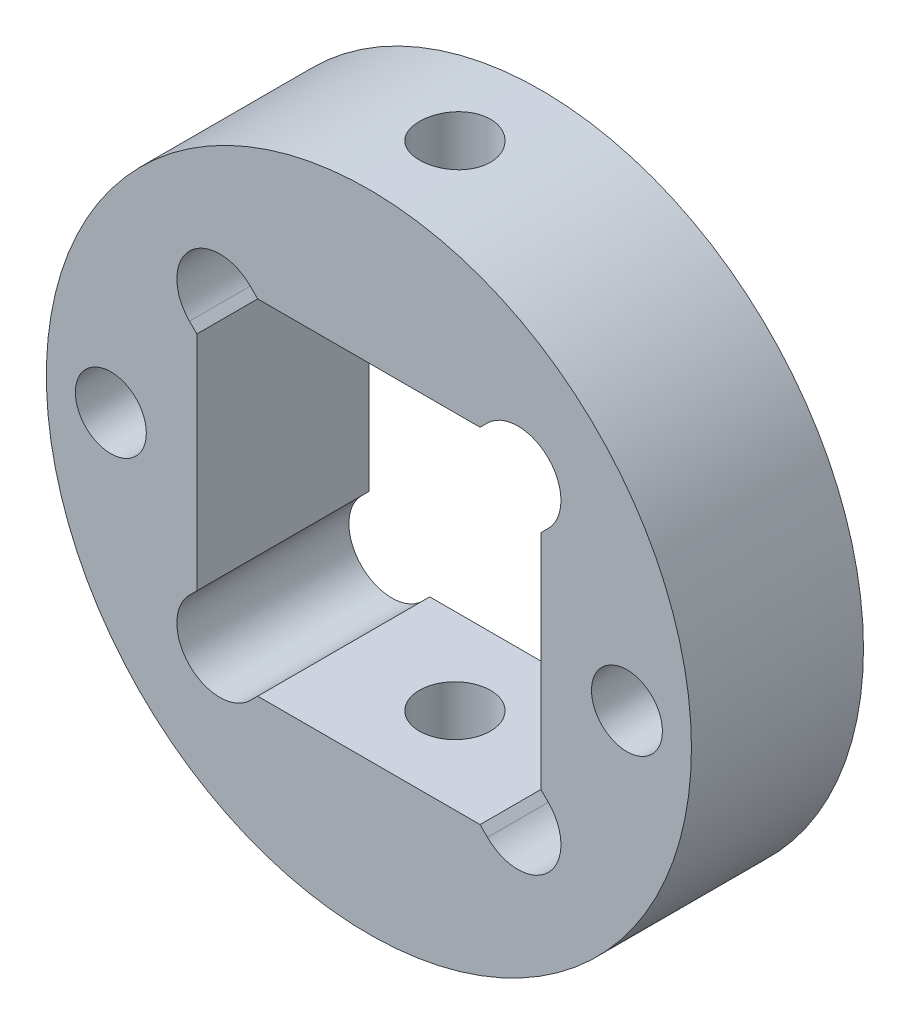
SolidWorks part; units mm, degrees
ref_plane "Plan de face" through (0, 0, 0) normal (0, 0, 1) x (1, 0, 0)
ref_plane "Plan de dessus" through (0, 0, 0) normal (0, 1, 0) x (1, 0, 0)
ref_plane "Plan de droite" through (0, 0, 0) normal (1, 0, 0) x (0, 0, -1)
sketch "Esquisse1" plane through (0, 0, 0) normal (0, 0, 1) x (1, 0, 0)
  line L0 (7.9903, 7.9903) -> (10.6336, 5.347) construction
  line L1 (-5.1716, 8) -> (5.1716, 8)
  line L2 (-8, 5.1716) -> (-8, -5.1716)
  line L3 (-5.1716, -8) -> (5.1716, -8)
  line L4 (8, 5.1716) -> (8, -5.1716)
  line L5 (7.9903, 7.9903) -> (6.9296, 6.9296) construction
  line L6 (8.3439, 5.5154) -> (3.5743, 10.285) construction
  line L7 (5.5154, 8.3439) -> (5.1716, 8)
  line L8 (8.3439, 5.5154) -> (8, 5.1716)
  line L9 (8.3439, -5.5154) -> (8, -5.1716)
  line L10 (5.5154, -8.3439) -> (5.1716, -8)
  line L11 (7.9903, -7.9903) -> (6.9296, -6.9296) construction
  line L12 (-5.5154, -8.3439) -> (-5.1716, -8)
  line L13 (-8.3439, -5.5154) -> (-8, -5.1716)
  line L14 (-7.9903, -7.9903) -> (-6.9296, -6.9296) construction
  line L15 (-8.3439, 5.5154) -> (-8, 5.1716)
  line L16 (-5.5154, 8.3439) -> (-5.1716, 8)
  line L17 (-7.9903, 7.9903) -> (-6.9296, 6.9296) construction
  arc A0 (8.3439, 5.5154) -> (5.5154, 8.3439) centre (6.9296, 6.9296) ccw
  arc A1 (5.5154, -8.3439) -> (8.3439, -5.5154) centre (6.9296, -6.9296) ccw
  arc A2 (-8.3439, -5.5154) -> (-5.5154, -8.3439) centre (-6.9296, -6.9296) ccw
  arc A3 (-5.5154, 8.3439) -> (-8.3439, 5.5154) centre (-6.9296, 6.9296) ccw
  circle A4 centre (0, 0) radius 15
  point P0 (-7.5417, 8.8)
  point P1 (8, -8)
  point P2 (-8, -8)
  point P4 (-15, 15)
  point P6 (15, 15)
  point P7 (15, -15)
  point P8 (-15, -15)
  point P10 (0, 0)
  dimension "D6" = 45
  dimension "D5" = 4
  dimension "D1" = 16
  dimension "D2" = 8
  dimension "D4" = 8
  dimension "D7" = 9.8
  dimension "D8" = 4
extrude "Boss.-Extru.1" add sketch "Esquisse1" along normal mid plane 8
hole_wizard "Trou taraudé M41" positions "Esquisse3" profile "Esquisse2" tap size "M4" standard "ISO"
sketch "Esquisse3" plane through (0, 0, 4) normal (0, 0, 1) x (1, 0, 0)
  point P0 (12, 0)
  dimension "D1" = 12
sketch "Esquisse2" plane through (12, 0, 4) normal (1, 0, 0) x (0, -1, 0)
  line L0 (0, 0) -> (0, 8)
  line L1 (0, 8) -> (1.65, 8)
  line L2 (1.65, 8) -> (1.65, 0)
  line L5 (1.65, 0) -> (0, 0)
  line L11 (0, -6.35) -> (0, 107.95) construction
  dimension "Diamètre du trou pour taraudage jusqu'au prochain" = 3.3
  dimension "Profondeur du trou pour taraudage jusqu'au prochain" = 8
mirror "Symétrie1" about plane through (0, 0, 0) normal (1, 0, 0) of "Trou taraudé M41"
hole_wizard "Trou taraudé M42" positions "Esquisse5" profile "Esquisse4" tap size "M4" standard "ISO"
sketch "Esquisse5" plane through (0, -8, 0) normal (0, 1, 0) x (-1, 0, 0)
  point P0 (0, 0)
sketch "Esquisse4" plane through (0, -8, 0) normal (1, 0, 0) x (0, 0, 1)
  line L0 (0, 0) -> (0, 7)
  line L1 (0, 7) -> (1.65, 7)
  line L2 (1.65, 7) -> (1.65, 0)
  line L5 (1.65, 0) -> (0, 0)
  line L11 (0, -6.35) -> (0, 107.95) construction
  dimension "Diamètre du trou pour taraudage jusqu'au prochain" = 3.3
  dimension "Profondeur du trou pour taraudage jusqu'au prochain" = 7
mirror "Symétrie2" about plane through (0, 0, 0) normal (0, 1, 0) of "Trou taraudé M42"
